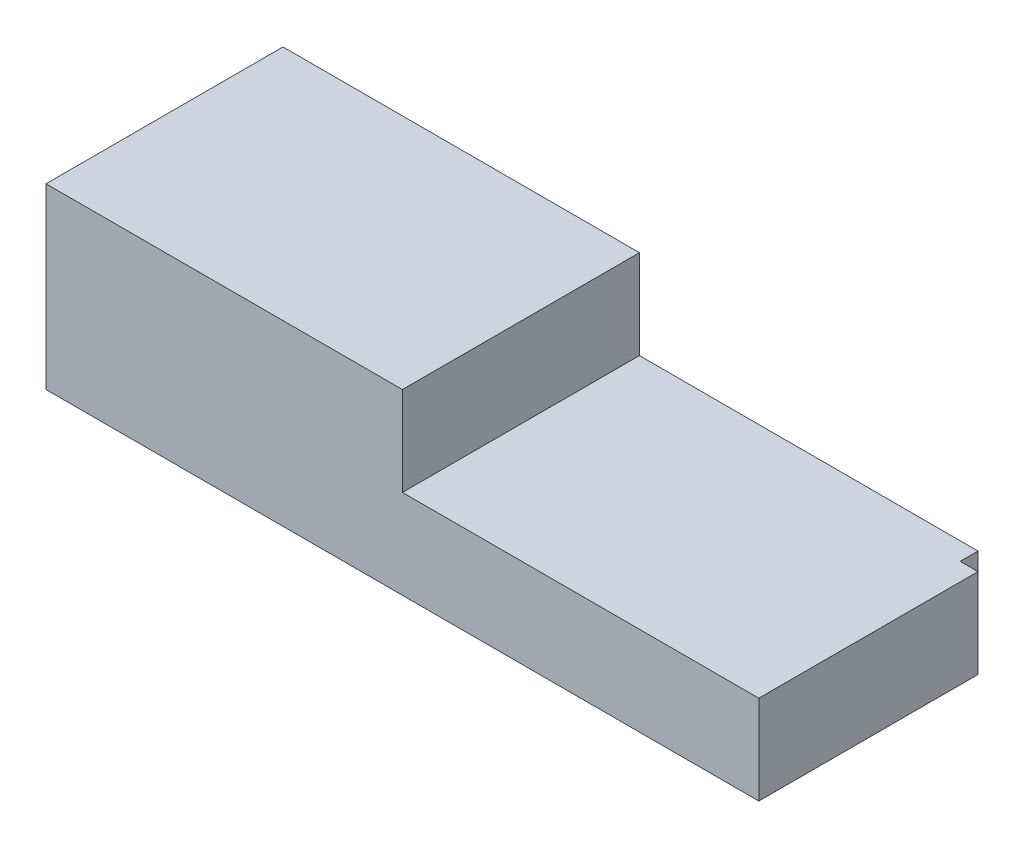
SolidWorks part; units mm, degrees
ref_plane "前视基准面" through (0, 0, 0) normal (0, 0, 1) x (1, 0, 0)
ref_plane "上视基准面" through (0, 0, 0) normal (0, 1, 0) x (1, 0, 0)
ref_plane "右视基准面" through (0, 0, 0) normal (1, 0, 0) x (0, 0, -1)
sketch "草图1" plane through (0, 0, 0) normal (0, 0, 1) x (1, 0, 0)
  line L0 (40, 0) -> (40, 5)
  line L1 (0, 0) -> (0, 10)
  line L2 (20, 5) -> (20, 10)
  line L3 (0, 0) -> (40, 0)
  line L4 (0, 10) -> (20, 10)
  line L5 (20, 5) -> (40, 5)
extrude "凸台-拉伸1" add sketch "草图1" along normal blind 13.3
sketch "草图2" plane through (0, 10, 0) normal (0, 1, 0) x (1, 0, 0)
  line L0 (39, -1) -> (40, -1)
  line L1 (39, -1) -> (39, 0)
extrude "切除-拉伸1" cut sketch "草图2" against normal through all and the other way through all flip side to cut
sketch "草图3" plane through (20, 0, 0) normal (1, 0, 0) x (0, 0, -1)
  circle A0 centre (-6.1, 5) radius 1.65
sketch "草图4" plane through (0, 0, 0) normal (-1, 0, 0) x (0, 0, 1)
  circle A0 centre (6.1, 5) radius 1.65
extrude "切除-拉伸2" cut sketch "草图4" against normal blind 5
